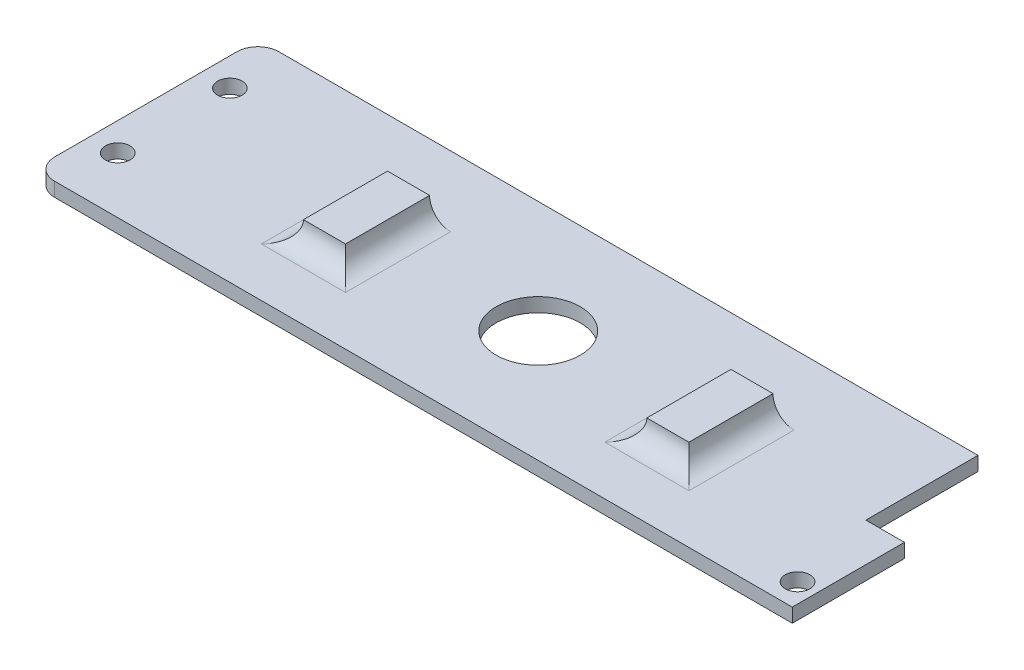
SolidWorks part; units mm, degrees
ref_plane "Front Plane" through (0, 0, 0) normal (0, 0, 1) x (1, 0, 0)
ref_plane "Top Plane" through (0, 0, 0) normal (0, 1, 0) x (1, 0, 0)
ref_plane "Right Plane" through (0, 0, 0) normal (1, 0, 0) x (0, 0, -1)
body saved out of another part "Stock-motor_hanger-1"
